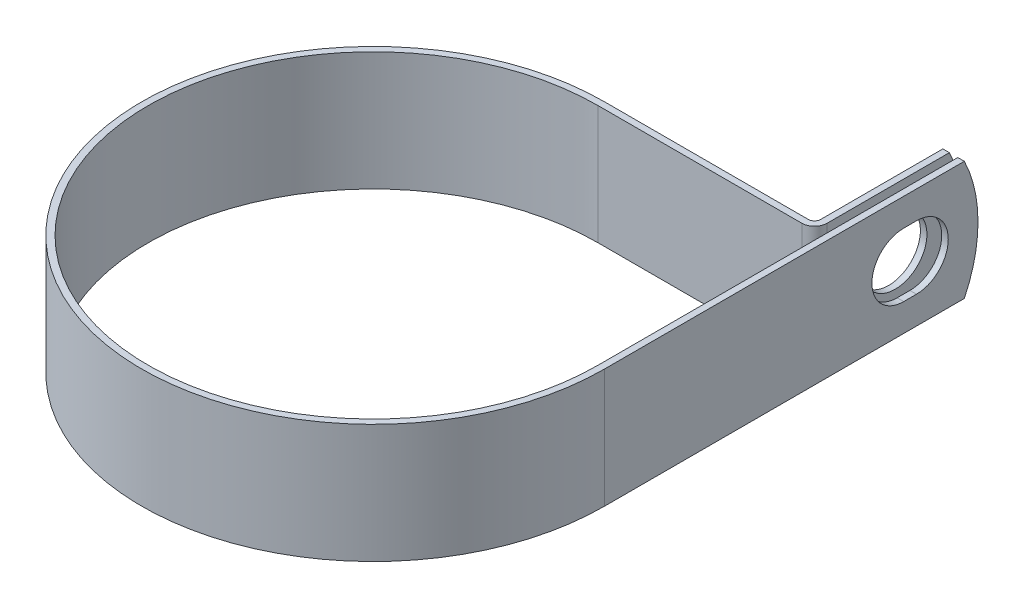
SolidWorks part; units mm, degrees
ref_plane "Front Plane" through (0, 0, 0) normal (0, 0, 1) x (1, 0, 0)
ref_plane "Top Plane" through (0, 0, 0) normal (0, 1, 0) x (1, 0, 0)
ref_plane "Right Plane" through (0, 0, 0) normal (1, 0, 0) x (0, 0, -1)
sketch "Sketch1" plane through (0, 0, 0) normal (0, 1, 0) x (1, 0, 0)
  line L0 (0, 42.0624) -> (38.1102, 42.0624)
  line L1 (42.0624, 0) -> (42.0624, 42.0624)
  line L2 (40.4876, 69.85) -> (40.4876, 44.4398)
  line L5 (42.0624, 42.0624) -> (42.0624, 69.85)
  arc A0 (0, 42.0624) -> (42.0624, 0) centre (0, 0) ccw
  arc A3 (38.1102, 42.0624) -> (40.4876, 44.4398) centre (38.1102, 44.4398) ccw
extrude "Extrude-Thin1" add sketch "Sketch1" along normal mid plane 22.225 thin
sketch "Sketch2" plane through (39.2684, 0, 0) normal (-1, 0, 0) x (0, 0, 1)
  line L0 (-69.85, 11.1125) -> (-69.85, -11.1125) construction
  line L7 (0, 11.1125) -> (0, -11.1125) construction
  circle A0 centre (-57.15, 0) radius 5.9436
  point P2 (-69.85, 0)
extrude "Cut-Extrude1" cut sketch "Sketch2" against normal up to surface (1.2192 mm away)
sketch "Sketch3" plane through (43.2816, 0, 0) normal (1, 0, 0) x (0, 0, -1)
  line L0 (55.9562, 0) -> (58.3438, 0) construction
  line L1 (55.9562, 5.9436) -> (58.3438, 5.9436)
  line L2 (55.9562, -5.9436) -> (58.3438, -5.9436)
  line L3 (69.85, 11.1125) -> (69.85, -11.1125) construction
  arc A0 (55.9562, 5.9436) -> (55.9562, -5.9436) centre (55.9562, 0) ccw
  arc A1 (58.3438, -5.9436) -> (58.3438, 5.9436) centre (58.3438, 0) ccw
  point P3 (57.15, 0)
  point P8 (69.85, 0)
  point P11 (50.0126, 0)
  point P12 (64.2874, 0)
extrude "Cut-Extrude2" cut sketch "Sketch3" against normal up to surface (1.2192 mm away)
sketch "Sketch4" plane through (39.2684, 0, 0) normal (-1, 0, 0) x (0, 0, 1)
  line L0 (-69.85, 11.1125) -> (-69.85, -11.1125)
  line L1 (-69.85, 11.1125) -> (-67.2901, 11.1125)
  line L2 (-69.85, 11.1125) -> (-44.4398, 11.1125) construction
  line L3 (-69.85, -11.1125) -> (-67.2901, -11.1125)
  line L4 (-69.85, -11.1125) -> (-44.4398, -11.1125) construction
  arc A0 (-67.2901, 11.1125) -> (-67.2901, -11.1125) centre (-44.45, 0) ccw
extrude "Cut-Extrude3" cut sketch "Sketch4" against normal through all contours A0 M4 M5 | A0 L0 M2
equation "\"D1@Sketch3\" = \"D2@Sketch2\""
equation "\"D7@Sketch1\" = \"D3@Sketch2\" + \"D1@Sketch3\""
equation "\"D1@Sketch4\" = ( \"D1@Extrude-Thin1\" + .125 ) * 2"
equation "\"D2@Sketch1\"=1.95*\"D5@Extrude-Thin1\""
equation "\"D2@Sketch3\" = \"D1@Sketch2\""
